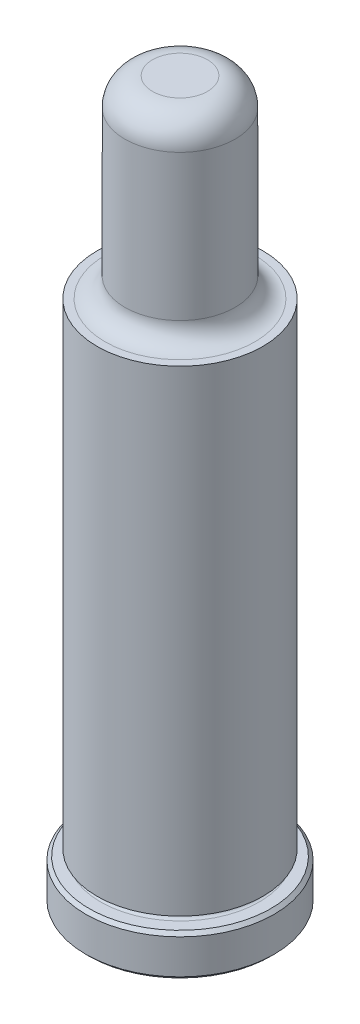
SolidWorks part; units mm, degrees
ref_plane "Front Plane" through (0, 0, 0) normal (0, 0, 1) x (1, 0, 0)
ref_plane "Top Plane" through (0, 0, 0) normal (0, 1, 0) x (1, 0, 0)
ref_plane "Right Plane" through (0, 0, 0) normal (1, 0, 0) x (0, 0, -1)
sketch "Sketch1" plane through (0, 0, 0) normal (1, 0, 0) x (0, 0, -1)
  line L0 (0, 0) -> (10.8331, 0)
  line L1 (10.8331, 0) -> (10.8331, 4.7498)
  line L2 (10.8331, 4.7498) -> (9.1313, 4.7498)
  line L3 (8.7503, 2.6782) -> (8.7503, 5.9795) construction
  line L4 (9.1313, 5.5118) -> (9.5377, 5.5118)
  line L5 (9.5377, 5.5118) -> (9.5377, 60.325)
  line L6 (9.5377, 60.325) -> (8.6233, 60.325)
  line L7 (6.3373, 62.611) -> (6.3373, 82.55)
  line L9 (6.3373, 82.55) -> (0, 82.55)
  line L10 (0, 82.55) -> (0, 0)
  line L11 (0, 0) -> (0, -7.2694) construction
  arc A0 (9.1313, 5.5118) -> (9.1313, 4.7498) centre (9.1313, 5.1308) ccw
  arc A1 (8.6233, 60.325) -> (6.3373, 62.611) centre (8.6233, 62.611) cw
  point P2 (6.3373, 82.55)
  point P14 (6.3373, 82.3999)
  point P19 (6.3373, 60.325)
  dimension "D14" = 0.762
  dimension "D8" = 2.286
  dimension "T" = 4.7498
  dimension "D2" = 0.762
  dimension "M" = 21.6662
  dimension "B" = 19.0754
  dimension "L" = 82.55
  dimension "D7" = 0.7874
  dimension "A" = 60.325
  dimension "D" = 12.6746
  dimension "D15" = 22.225
revolve "Revolve1" add sketch "Sketch1" angle 360 about L11
fillet "Fillet6" radius 3.175 1 edges at (0, 82.55, 6.3373)
chamfer "Chamfer1" distance 0.381 angle 45 2 edges at (0, 0, 10.8331) (0, 4.7498, 10.8331)
